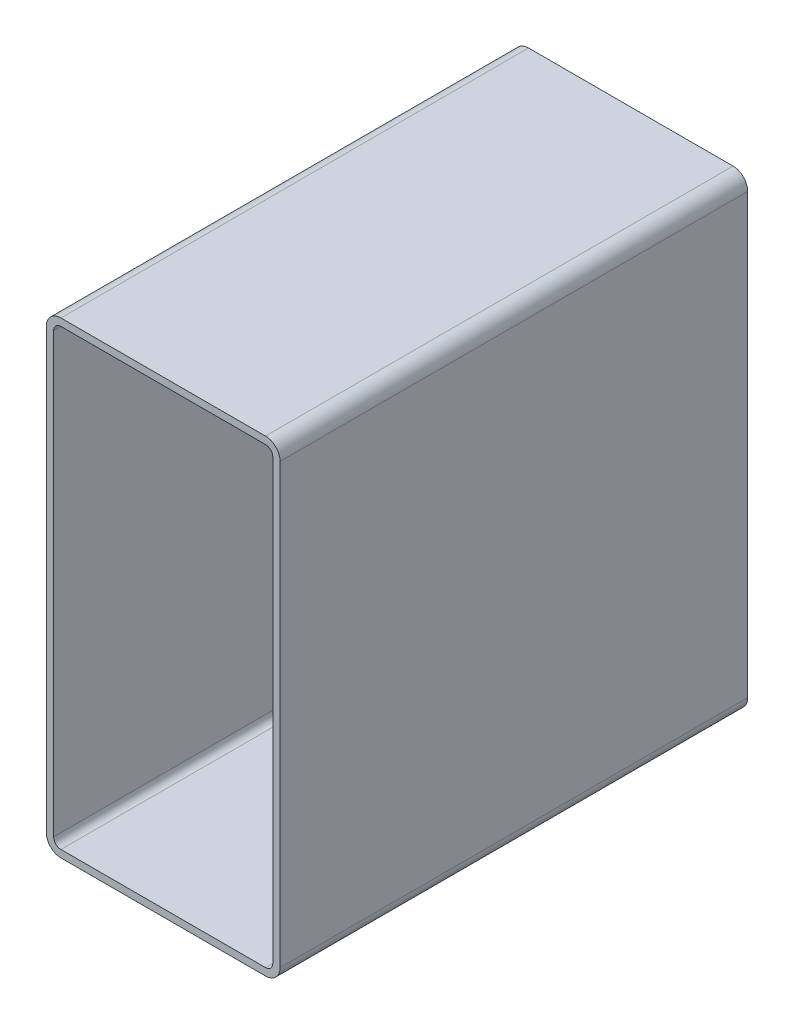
SolidWorks part; units mm, degrees
ref_plane "Front Plane" through (0, 0, 0) normal (0, 0, 1) x (1, 0, 0)
ref_plane "Top Plane" through (0, 0, 0) normal (0, 1, 0) x (1, 0, 0)
ref_plane "Right Plane" through (0, 0, 0) normal (1, 0, 0) x (0, 0, -1)
sketch "Sketch1" plane through (0, 0, 0) normal (0, 0, 1) x (1, 0, 0)
sketch_block_instance "HSS12x6x0.1875-1"
sketch_block "HSS12x6x0.1875"
extrude "Boss-Extrude1" add sketch "Sketch1" along normal blind 304.8
